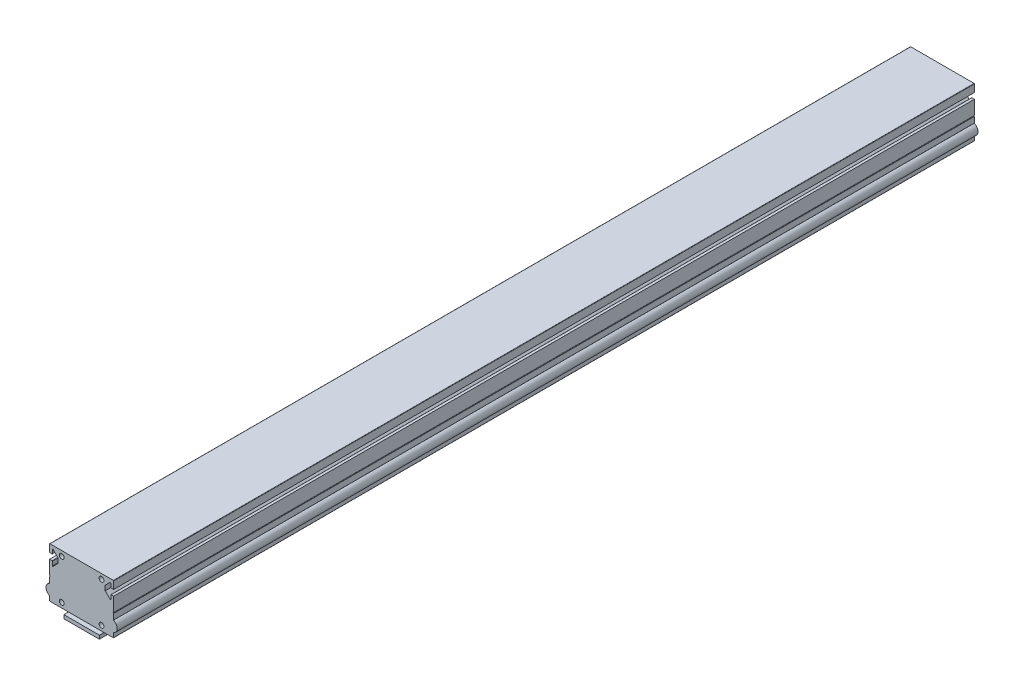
SolidWorks part; units mm, degrees
ref_plane "Ebene vorne" through (0, 0, 0) normal (0, 0, 1) x (1, 0, 0)
ref_plane "Ebene oben" through (0, 0, 0) normal (0, 1, 0) x (1, 0, 0)
ref_plane "Ebene rechts" through (0, 0, 0) normal (1, 0, 0) x (0, 0, -1)
sketch "Skizze1" plane through (0, 0, 0) normal (0, 0, 1) x (1, 0, 0)
  line L0 (0, -28.3625) -> (0, 25.1272) construction
  line L1 (-45, 35) -> (45, 35)
  line L2 (-45, 35) -> (-45, -35)
  line L3 (-45, -35) -> (45, -35)
  line L4 (45, 35) -> (45, -35)
  line L5 (-16.392, 0) -> (38.3918, 0) construction
  line L7 (-25, -41.5) -> (25, -41.5)
  line L8 (-25, -41.5) -> (-25, -46.5)
  line L9 (-25, -46.5) -> (25, -46.5)
  line L10 (25, -41.5) -> (25, -46.5)
  line L11 (-25, -41.5) -> (25, -46.5) construction
  line L12 (-25, -46.5) -> (25, -41.5) construction
  point P8 (0, -44)
  dimension "D1" = 70
  dimension "D2" = 90
  dimension "D3" = 45
  dimension "D4" = 35
  dimension "D5" = 50
  dimension "D6" = 5
  dimension "D7" = 45
  dimension "D8" = 6.5
extrude "Linear austragen1" add sketch "Skizze1" along normal blind 1210
sketch "Skizze5" plane through (0, 0, 0) normal (0, 0, -1) x (-1, 0, 0)
  line L0 (45, 35) -> (45, -35) construction
  line L1 (45, 24.05) -> (45, 15.95)
  line L2 (45, 24.05) -> (41.5, 24.05)
  line L3 (41, 24.55) -> (41, 30)
  line L4 (40.1464, 30.3536) -> (33.2, 23.4071)
  line L5 (15.296, 20) -> (21.4231, 20) construction
  line L6 (-45, 35) -> (45, 35) construction
  line L7 (45, 15.95) -> (41.5, 15.95)
  line L8 (41, 15.45) -> (41, 10)
  line L9 (40.1464, 9.6464) -> (33.2, 16.5929)
  line L10 (33.2, 23.4071) -> (33.2, 16.5929)
  arc A0 (40.1464, 30.3536) -> (41, 30) centre (40.5, 30) cw
  arc A1 (41.5, 24.05) -> (41, 24.55) centre (41.5, 24.55) cw
  arc A2 (41.5, 15.95) -> (41, 15.45) centre (41.5, 15.45) ccw
  arc A3 (40.1464, 9.6464) -> (41, 10) centre (40.5, 10) ccw
  point P14 (41, 24.05)
  dimension "D6" = 0.5
  dimension "D1" = 4
  dimension "D2" = 4.05
  dimension "D3" = 15
  dimension "D4" = 45
  dimension "D5" = 11.8
  dimension "D7" = 10.5
extrude "Schnitt-Linear austragen4" cut sketch "Skizze5" against normal through all
sketch "Skizze4" plane through (0, 0, 0) normal (0, 0, -1) x (-1, 0, 0)
  line L0 (45, 35) -> (45, 24.05) construction
  line L1 (45, -35) -> (-45, -35) construction
  line L2 (42, -21) -> (15.2489, 5.7511) construction
  line L3 (45, -13.5299) -> (45, -28.4701)
  arc A0 (45, -13.5299) -> (45, -28.4701) centre (42, -21) ccw
  dimension "D1" = 16.1
  dimension "D2" = 3
  dimension "D3" = 14
  dimension "D4" = 45
extrude "Schnitt-Linear austragen3" cut sketch "Skizze4" against normal through all
sketch "Skizze8" plane through (0, 0, 0) normal (0, 0, -1) x (-1, 0, 0)
  line L0 (45, 15.95) -> (45, -13.5299) construction
  line L3 (45, -3.8) -> (45, -5)
  line L4 (17.5007, -4.4) -> (34.0595, -4.4) construction
  line L5 (45, -35) -> (-45, -35) construction
  arc A0 (45, -3.8) -> (45, -5) centre (45, -4.4) ccw
  dimension "D2" = 0.6
  dimension "D1" = 0.6
  dimension "D4" = 30.6
extrude "Schnitt-Linear austragen5" cut sketch "Skizze8" against normal through all
hole_wizard "Ø6.7 (6.7) Durchmesser Bohrung1" positions "Skizze7" profile "Skizze6" hole size "Ø6.7" standard "DIN"
sketch "Skizze7" plane through (0, 0, 0) normal (0, 0, -1) x (-1, 0, 0)
  point P1 (28, -28)
  point P3 (28, 28)
sketch "Skizze6" plane through (-28, -28, 0) normal (1, 0, 0) x (0, 1, 0)
  line L0 (0, 0) -> (0, 1210)
  line L1 (0, 1210) -> (3.35, 1210)
  line L2 (3.35, 1210) -> (3.35, 0)
  line L5 (3.35, 0) -> (0, 0)
  line L11 (0, -6.35) -> (0, 107.95) construction
  dimension "Bohrerdurchmesser" = 6.7
  dimension "Bohrungstiefe" = 1210
mirror "Spiegeln1" about plane through (0, 0, 0) normal (1, 0, 0) of "Schnitt-Linear austragen5", "Ø6.7 (6.7) Durchmesser Bohrung1", "Schnitt-Linear austragen4", "Schnitt-Linear austragen3"
fillet "Verrundung1" radius 0.3 4 edges at (-45, -28.4701, 605) (-45, -13.5299, 605) (45, -13.5299, 605) (45, -28.4701, 605)
fillet "Verrundung2" radius 0.5 4 edges at (45, 35, 605) (45, -35, 605) (-45, -35, 605) (-45, 35, 605)
sketch "Skizze9" plane through (0, 0, 0) normal (0, 0, -1) x (-1, 0, 0)
  circle A0 centre (-42, -21) radius 8.05
  circle A1 centre (42, -21) radius 8.05
  dimension "D1" = 16.1
  dimension "D2" = 16.1
extrude "Linear austragen2" add sketch "Skizze9" against normal up to surface (1210 mm away)
